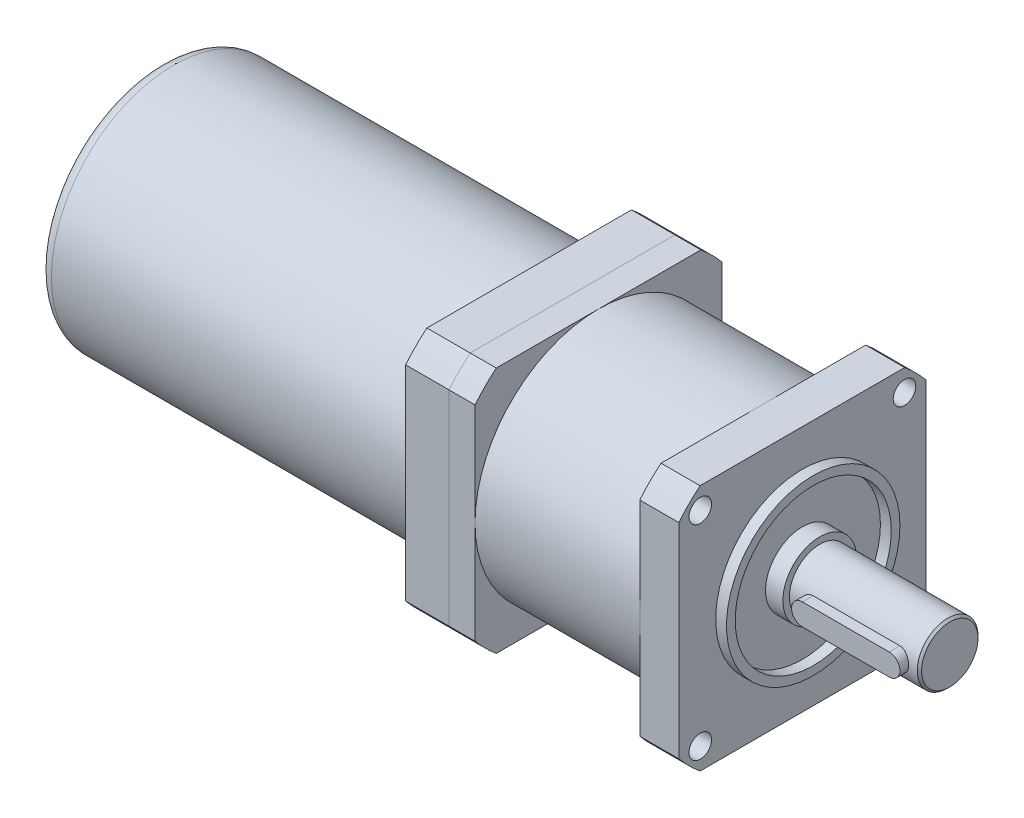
SolidWorks part; units mm, degrees
ref_plane "前视基准面" through (0, 0, 0) normal (0, 0, 1) x (1, 0, 0)
ref_plane "上视基准面" through (0, 0, 0) normal (0, 1, 0) x (1, 0, 0)
ref_plane "右视基准面" through (0, 0, 0) normal (1, 0, 0) x (0, 0, -1)
sketch "草图1" plane through (0, 0, 0) normal (1, 0, 0) x (0, 0, -1)
  line L1 (-23.5956, -28.5) -> (23.5956, -28.5)
  line L2 (-28.5, -23.5956) -> (-28.5, 23.5956)
  line L3 (-23.5956, 28.5) -> (23.5956, 28.5)
  line L4 (28.5, -23.5956) -> (28.5, 23.5956)
  line L5 (-26.163, -26.163) -> (26.163, 26.163) construction
  line L6 (-26.163, 26.163) -> (26.163, -26.163) construction
  arc A0 (-28.5, -23.5956) -> (-23.5956, -28.5) centre (0, 0) ccw
  arc A1 (-23.5956, 28.5) -> (-28.5, 23.5956) centre (0, 0) ccw
  arc A2 (28.5, 23.5956) -> (23.5956, 28.5) centre (0, 0) ccw
  arc A3 (23.5956, -28.5) -> (28.5, -23.5956) centre (0, 0) ccw
  point P0 (0, 0)
extrude "凸台-拉伸1" add sketch "草图1" against normal blind 9
sketch "草图2" plane through (-9, 0, 0) normal (-1, 0, 0) x (0, 0, 1)
  circle A0 centre (0, 0) radius 28.5
extrude "凸台-拉伸2" add sketch "草图2" along normal blind 38
sketch "草图3" plane through (-47, 0, 0) normal (-1, 0, 0) x (0, 0, 1)
  line L1 (-23.5956, -28.5) -> (23.5956, -28.5)
  line L2 (-28.5, -23.5956) -> (-28.5, 23.5956)
  line L3 (-23.5956, 28.5) -> (23.5956, 28.5)
  line L4 (28.5, -23.5956) -> (28.5, 23.5956)
  line L5 (-26.163, -26.163) -> (26.163, 26.163) construction
  line L6 (-26.163, 26.163) -> (26.163, -26.163) construction
  arc A0 (-28.5, -23.5956) -> (-23.5956, -28.5) centre (0, 0) ccw
  arc A1 (23.5956, -28.5) -> (28.5, -23.5956) centre (0, 0) ccw
  arc A2 (28.5, 23.5956) -> (23.5956, 28.5) centre (0, 0) ccw
  arc A3 (-23.5956, 28.5) -> (-28.5, 23.5956) centre (0, 0) ccw
  point P0 (0, 0)
extrude "凸台-拉伸3" add sketch "草图3" along normal blind 6
sketch "草图6" plane through (0, 0, 0) normal (1, 0, 0) x (0, 0, -1)
  circle A0 centre (-23.55, 23.55) radius 2.6
  circle A1 centre (23.55, 23.55) radius 2.6
  circle A2 centre (23.55, -23.55) radius 2.6
  circle A3 centre (-23.55, -23.55) radius 2.6
  point P0 (0, 0)
extrude "切除-拉伸2" cut sketch "草图6" against normal blind 9
sketch "草图7" plane through (0, 0, 0) normal (1, 0, 0) x (0, 0, -1)
  circle A0 centre (0, 0) radius 20
  circle A1 centre (0, 0) radius 18
extrude "凸台-拉伸5" add sketch "草图7" along normal blind 2.5
sketch "草图8" plane through (0, 0, 0) normal (1, 0, 0) x (0, 0, -1)
  circle A0 centre (0, 0) radius 8.5
extrude "凸台-拉伸6" add sketch "草图8" along normal blind 4
sketch "草图9" plane through (4, 0, 0) normal (1, 0, 0) x (0, 0, -1)
  circle A0 centre (0, 0) radius 7
extrude "凸台-拉伸7" add sketch "草图9" along normal blind 30
ref_plane "基准面1" through (0, 0, 7) normal (0, 0, 1) x (1, 0, 0)
sketch "草图10" plane through (0, 0, 7) normal (0, 0, 1) x (1, 0, 0)
  line L3 (9, 2.5) -> (29, 2.5)
  line L5 (29, -2.5) -> (9, -2.5)
  arc A0 (29, -2.5) -> (29, 2.5) centre (29, 0) ccw
  arc A1 (9, 2.5) -> (9, -2.5) centre (9, 0) ccw
extrude "切除-拉伸3" cut sketch "草图10" against normal blind 3
sketch "草图11" plane through (0, 0, 4) normal (0, 0, 1) x (1, 0, 0)
  line L0 (9, 2.5) -> (29, 2.5)
  line L2 (29, -2.5) -> (9, -2.5)
  arc A0 (9, 2.5) -> (9, -2.5) centre (9, 0) ccw
  arc A1 (29, -2.5) -> (29, 2.5) centre (29, 0) ccw
extrude "凸台-拉伸8" add sketch "草图11" along normal blind 5
chamfer "倒角1" distance 0.5 angle 45 1 edges at (34, 0, -7)
sketch "草图14" plane through (-53, 0, 0) normal (-1, 0, 0) x (0, 0, 1)
  line L1 (-23.5956, -28.5) -> (23.5956, -28.5)
  line L2 (-28.5, -23.5956) -> (-28.5, 23.5956)
  line L3 (-23.5956, 28.5) -> (23.5956, 28.5)
  line L4 (28.5, -23.5956) -> (28.5, 23.5956)
  line L5 (-26.163, -26.163) -> (26.163, 26.163) construction
  line L6 (-26.163, 26.163) -> (26.163, -26.163) construction
  arc A0 (-23.5956, 28.5) -> (-28.5, 23.5956) centre (0, 0) ccw
  arc A1 (-28.5, -23.5956) -> (-23.5956, -28.5) centre (0, 0) ccw
  arc A2 (23.5956, -28.5) -> (28.5, -23.5956) centre (0, 0) ccw
  arc A3 (28.5, 23.5956) -> (23.5956, 28.5) centre (0, 0) ccw
  point P0 (0, 0)
extrude "凸台-拉伸9" add sketch "草图14" along normal blind 10 separate body
sketch "草图15" plane through (-63, 0, 0) normal (-1, 0, 0) x (0, 0, 1)
  circle A0 centre (0, 0) radius 28.2
extrude "凸台-拉伸10" add sketch "草图15" along normal blind 85
fillet "圆角1" radius 3 1 edges at (-148, 0, 28.2)
